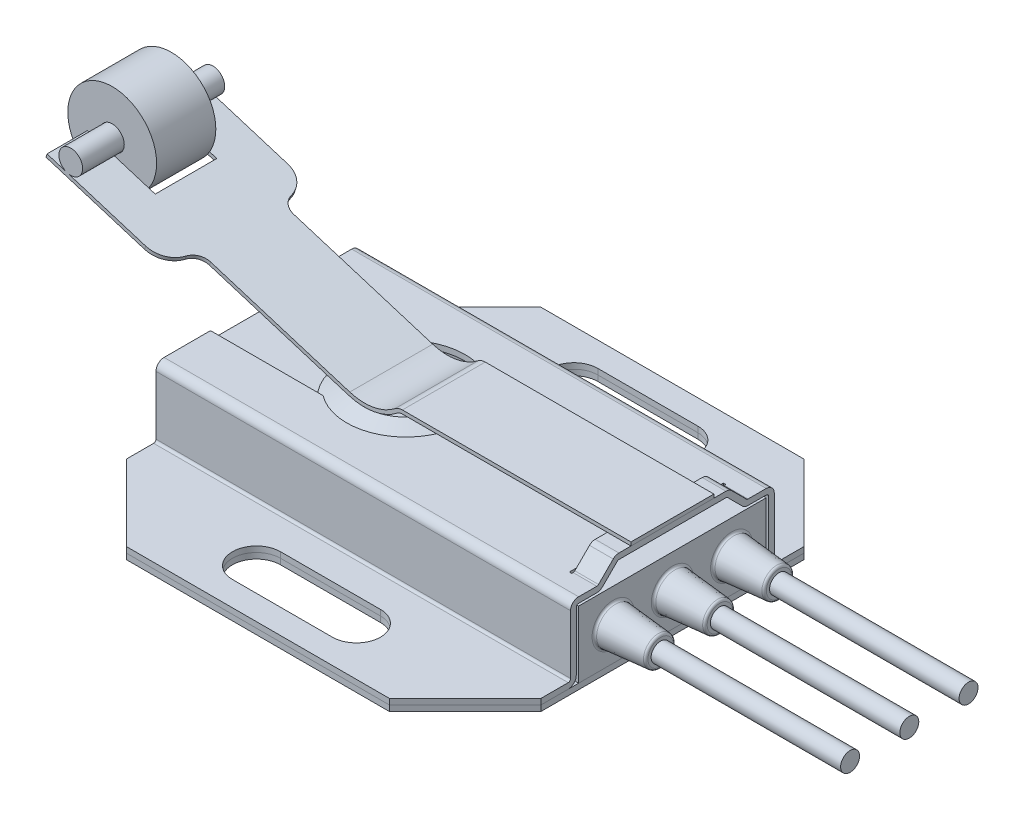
SolidWorks part; units mm, degrees
ref_plane "Front" through (0, 0, 0) normal (0, 0, 1) x (1, 0, 0)
ref_plane "Top" through (0, 0, 0) normal (0, 1, 0) x (1, 0, 0)
ref_plane "Right" through (0, 0, 0) normal (1, 0, 0) x (0, 0, -1)
sketch "Sketch1" plane through (0, 0, 0) normal (0, 1, 0) x (1, 0, 0)
  line L0 (-22.225, 0) -> (-5.3594, 0) construction
  line L1 (-22.225, 22.225) -> (-22.225, -22.225)
  line L2 (-22.225, -22.225) -> (22.225, -22.225)
  line L4 (5.3594, 17.018) -> (-5.3594, 17.018) construction
  line L5 (-5.3594, -17.018) -> (5.3594, -17.018) construction
  line L6 (5.3594, 19.5961) -> (-5.3594, 19.5961) construction
  line L7 (-5.3594, -19.5961) -> (5.3594, -19.5961) construction
  line L8 (5.3594, 14.4399) -> (-5.3594, 14.4399) construction
  line L9 (-5.3594, -14.4399) -> (5.3594, -14.4399) construction
  line L10 (-5.3594, 17.018) -> (-5.3594, -17.018) construction
  line L11 (22.225, 22.225) -> (22.225, -22.225)
  line L12 (22.225, 22.225) -> (-22.225, 22.225)
  line L13 (-22.225, -22.225) -> (22.225, 22.225) construction
  line L14 (-22.225, 14.097) -> (-14.097, 22.225) construction
  line L15 (14.097, 22.225) -> (22.225, 14.097) construction
  line L16 (22.225, -14.097) -> (14.097, -22.225) construction
  line L17 (-22.225, -14.097) -> (-14.097, -22.225) construction
  line L18 (-14.097, -22.225) -> (-17.834, -18.488) construction
  arc A0 (5.3594, 19.5961) -> (5.3594, 14.4399) centre (5.3594, 17.018) cw construction
  arc A1 (-5.3594, 19.5961) -> (-5.3594, 14.4399) centre (-5.3594, 17.018) ccw construction
  arc A2 (-5.3594, -19.5961) -> (-5.3594, -14.4399) centre (-5.3594, -17.018) cw construction
  arc A3 (5.3594, -19.5961) -> (5.3594, -14.4399) centre (5.3594, -17.018) ccw construction
  point P16 (0, -19.5961)
  dimension "D4" = 34.036
  dimension "D2" = 15.875
  dimension "D1" = 5.1562
  dimension "D3" = 44.45
  dimension "D5" = 44.45
  dimension "D6" = 22.225
  dimension "D7" = 8.128
extrude "Extrude1" add sketch "Sketch1" along normal blind 0.6096
sketch "Sketch2" plane through (22.225, 0, 0) normal (-1, 0, 0) x (0, 0, 1)
  line L0 (10.922, 8.636) -> (8.001, 8.636)
  line L1 (8.001, 8.636) -> (6.096, 10.541)
  line L2 (6.096, 10.541) -> (-6.096, 10.541)
  line L3 (-6.096, 10.541) -> (-8.001, 8.636)
  line L4 (-8.001, 8.636) -> (-10.922, 8.636)
  line L5 (-10.922, 8.636) -> (-10.922, 8.0264)
  line L6 (-10.922, 8.0264) -> (-10.3124, 8.0264) construction
  line L7 (-7.7485, 8.0264) -> (-5.8435, 9.9314)
  line L8 (-5.8435, 9.9314) -> (5.8435, 9.9314)
  line L9 (5.8435, 9.9314) -> (7.7485, 8.0264)
  line L10 (7.7485, 8.0264) -> (10.3124, 8.0264)
  line L11 (10.922, 1.2192) -> (10.922, 8.636)
  line L12 (0, 10.541) -> (0, 9.9314) construction
  line L13 (-7.0485, 9.5885) -> (-6.6174, 9.1574) construction
  line L14 (7.0485, 9.5885) -> (6.6174, 9.1574) construction
  line L15 (-10.922, 1.2192) -> (-22.225, 1.2192)
  line L16 (-22.225, 1.2192) -> (-22.225, 0.6096)
  line L17 (10.3124, 8.0264) -> (10.3124, 0.6096)
  line L18 (10.3124, 0.6096) -> (22.225, 0.6096)
  line L19 (-10.922, 8.0264) -> (-10.922, 1.2192)
  line L20 (-22.225, 0.6096) -> (-10.3124, 0.6096)
  line L21 (-10.3124, 0.6096) -> (-10.3124, 8.0264)
  line L22 (-10.3124, 8.0264) -> (-7.7485, 8.0264)
  line L23 (22.225, 0.6096) -> (22.225, 1.2192)
  line L24 (22.225, 1.2192) -> (10.922, 1.2192)
  line L25 (10.3124, 8.0264) -> (10.922, 8.0264) construction
  line L26 (-10.922, 1.2192) -> (-10.3124, 1.2192) construction
  line L27 (10.922, 1.2192) -> (10.3124, 1.2192) construction
  line L28 (22.225, 0) -> (-22.225, 0) construction
  dimension "D1" = 8.636
  dimension "D2" = 21.844
  dimension "D4" = 135
  dimension "D5" = 12.192
  dimension "D6" = 0.6096
  dimension "D7" = 10.541
extrude "Extrude2" add sketch "Sketch2" along normal blind 2.54 separate body
sketch "Sketch20" plane through (22.225, 0, 0) normal (1, 0, 0) x (0, 0, -1)
  line L0 (8.001, 8.636) -> (10.922, 8.636) construction
  line L1 (10.3124, 8.0264) -> (7.7485, 8.0264) construction
  line L2 (-10.922, 8.636) -> (-8.001, 8.636) construction
  line L3 (-7.7485, 8.0264) -> (-10.3124, 8.0264) construction
  line L4 (10.3124, 0.6096) -> (10.3124, 8.0264) construction
  line L5 (10.922, 8.0264) -> (10.922, 1.2192) construction
  line L6 (22.225, 1.2192) -> (22.225, 0.6096) construction
  line L7 (22.225, 0.6096) -> (10.3124, 0.6096) construction
  line L8 (10.922, 1.2192) -> (22.225, 1.2192) construction
  line L9 (-10.922, 1.2192) -> (-10.922, 8.636) construction
  line L10 (-10.3124, 8.0264) -> (-10.3124, 0.6096) construction
  line L11 (-22.225, 0.6096) -> (-22.225, 1.2192) construction
  line L12 (-10.3124, 0.6096) -> (-22.225, 0.6096) construction
  line L13 (-22.225, 1.2192) -> (-10.922, 1.2192) construction
  line L14 (8.255, 8.636) -> (10.922, 8.636)
  line L15 (10.3124, 8.0264) -> (8.255, 8.0264)
  line L16 (-10.922, 8.636) -> (-8.255, 8.636)
  line L17 (-8.255, 8.0264) -> (-10.3124, 8.0264)
  line L18 (10.3124, 0.6096) -> (10.3124, 8.0264)
  line L19 (10.922, 8.636) -> (10.922, 1.2192)
  line L20 (22.225, 1.2192) -> (22.225, 0.6096)
  line L21 (22.225, 0.6096) -> (10.3124, 0.6096)
  line L22 (10.922, 1.2192) -> (22.225, 1.2192)
  line L23 (-10.922, 1.2192) -> (-10.922, 8.636)
  line L24 (-10.3124, 8.0264) -> (-10.3124, 0.6096)
  line L25 (-22.225, 0.6096) -> (-22.225, 1.2192)
  line L26 (-10.3124, 0.6096) -> (-22.225, 0.6096)
  line L27 (-22.225, 1.2192) -> (-10.922, 1.2192)
  line L28 (-8.255, 8.636) -> (-8.255, 8.0264)
  line L29 (8.255, 8.636) -> (8.255, 8.0264)
  dimension "D1" = 0.254
  dimension "D2" = 0.254
extrude "Extrude14" add sketch "Sketch20" against normal up to surface (44.45 mm away)
sketch "Sketch21" plane through (0, 8.636, 0) normal (0, 1, 0) x (-1, 0, 0)
  line L0 (22.225, 8.255) -> (-19.685, 8.255) construction
  line L1 (22.225, -8.255) -> (-19.431, -8.255)
  line L2 (22.225, -8.255) -> (22.225, 8.255)
  line L3 (22.225, 8.255) -> (-19.431, 8.255)
  line L4 (-19.431, -8.255) -> (-19.431, 8.255)
  line L5 (-19.685, 8.255) -> (-19.685, 8.001) construction
  dimension "D1" = 0.254
extrude "Extrude15" add sketch "Sketch21" against normal up to surface (0.6096 mm away)
fillet "Fillet2" radius 0.254 8 edges at (20.955, 8.636, 8.001) (20.955, 8.636, -8.001) (20.955, 9.9314, -5.8435) (0, 8.0264, -10.3124) (20.955, 9.9314, 5.8435) (0, 1.2192, -10.922) (0, 1.2192, 10.922) (0, 8.0264, 10.3124)
fillet "Fillet3" radius 0.8636 8 edges at (20.955, 8.0264, 7.7485) (20.955, 8.0264, -7.7485) (0, 8.636, -10.922) (20.955, 10.541, -6.096) (20.955, 10.541, 6.096) (0, 8.636, 10.922) (0, 0.6096, -10.3124) (0, 0.6096, 10.3124)
sketch "Sketch11" plane through (-1.8288, 0, 0) normal (0, 1, 0) x (0, 0, 1)
  line L0 (14.4399, -3.5306) -> (14.4399, 7.1882) construction
  line L1 (19.5961, -3.5306) -> (19.5961, 7.1882) construction
  line L2 (-19.5961, 7.1882) -> (-19.5961, -3.5306) construction
  line L3 (-14.4399, 7.1882) -> (-14.4399, -3.5306) construction
  line L4 (14.4399, -3.5306) -> (14.4399, 7.1882)
  line L5 (19.5961, -3.5306) -> (19.5961, 7.1882)
  line L6 (-19.5961, 7.1882) -> (-19.5961, -3.5306)
  line L7 (-14.4399, 7.1882) -> (-14.4399, -3.5306)
  line L8 (-22.225, 24.0538) -> (22.225, 24.0538) construction
  line L9 (22.225, -20.3962) -> (22.225, 24.0538) construction
  line L10 (-22.225, -20.3962) -> (22.225, -20.3962) construction
  line L11 (-22.225, 24.0538) -> (-22.225, -20.3962) construction
  line L12 (-14.097, -20.3962) -> (-22.225, -12.2682) construction
  line L13 (14.097, -20.3962) -> (22.225, -12.2682) construction
  line L14 (14.097, 24.0538) -> (22.225, 15.9258) construction
  line L15 (-22.225, 15.9258) -> (-14.097, 24.0538) construction
  line L16 (-22.225, 24.0538) -> (-14.097, 24.0538)
  line L17 (22.225, -20.3962) -> (22.225, -12.2682)
  line L18 (-22.225, -20.3962) -> (-14.097, -20.3962)
  line L19 (-22.225, 24.0538) -> (-22.225, 15.9258)
  line L20 (-14.097, -20.3962) -> (-22.225, -12.2682)
  line L21 (14.097, -20.3962) -> (22.225, -12.2682)
  line L22 (14.097, 24.0538) -> (22.225, 15.9258)
  line L23 (-22.225, 15.9258) -> (-14.097, 24.0538)
  line L24 (-22.225, -12.2682) -> (-22.225, -20.3962)
  line L25 (14.097, 24.0538) -> (22.225, 24.0538)
  line L26 (22.225, 15.9258) -> (22.225, 24.0538)
  line L27 (14.097, -20.3962) -> (22.225, -20.3962)
  arc A0 (14.4399, -3.5306) -> (19.5961, -3.5306) centre (17.018, -3.5306) ccw construction
  arc A1 (19.5961, 7.1882) -> (14.4399, 7.1882) centre (17.018, 7.1882) ccw construction
  arc A2 (-14.4399, 7.1882) -> (-19.5961, 7.1882) centre (-17.018, 7.1882) ccw construction
  arc A3 (-19.5961, -3.5306) -> (-14.4399, -3.5306) centre (-17.018, -3.5306) ccw construction
  arc A4 (14.4399, -3.5306) -> (19.5961, -3.5306) centre (17.018, -3.5306) ccw
  arc A5 (19.5961, 7.1882) -> (14.4399, 7.1882) centre (17.018, 7.1882) ccw
  arc A6 (-14.4399, 7.1882) -> (-19.5961, 7.1882) centre (-17.018, 7.1882) ccw
  arc A7 (-19.5961, -3.5306) -> (-14.4399, -3.5306) centre (-17.018, -3.5306) ccw
extrude "Cut-Extrude3" cut sketch "Sketch11" along normal through all
ref_plane "Plane1" through (0, 0, 0) normal (0, 0, 1) x (1, 0, 0)
sketch "Sketch12" plane through (0, 0, 0) normal (0, 0, 1) x (1, 0, 0)
  line L0 (22.225, 10.541) -> (-2.288, 10.541)
  line L1 (-8.0392, 9.3994) -> (-37.3236, 18.46)
  line L2 (-37.3236, 18.46) -> (-37.211, 18.824)
  line L3 (-37.211, 18.824) -> (-7.9266, 9.7633)
  line L4 (-2.288, 10.922) -> (22.225, 10.922)
  line L5 (22.225, 10.922) -> (22.225, 10.541)
  line L8 (-22.225, 0) -> (-5.3594, 0) construction
  line L9 (-22.225, 8.636) -> (19.431, 8.636) construction
  line L10 (-22.225, 8.636) -> (19.431, 8.636) construction
  line L11 (-6.35, 14.859) -> (-6.35, 9.144) construction
  line L12 (-6.35, 9.144) -> (-6.35, 8.636) construction
  arc A0 (-2.288, 10.541) -> (-2.8348, 10.3529) centre (-2.288, 9.652) ccw
  arc A1 (-2.8348, 10.3529) -> (-8.0392, 9.3994) centre (-6.35, 14.859) cw
  arc A2 (-7.9266, 9.7633) -> (-3.0691, 10.6533) centre (-6.35, 14.859) ccw
  arc A3 (-3.0691, 10.6533) -> (-2.288, 10.922) centre (-2.288, 9.652) cw
  circle A4 centre (-34.671, 19.3675) radius 1.27 construction
  circle A5 centre (-34.671, 19.3675) radius 4.7625 construction
  point P21 (-34.671, 19.3675)
  dimension "D1" = 9.525
  dimension "D2" = 12.446
  dimension "D5" = 2.54
  dimension "D6" = 28.575
  dimension "D7" = 2.54
  dimension "D8" = 5.715
  dimension "D9" = 1.27
  dimension "D3" = 24.13
  dimension "D4" = 0.381
  dimension "D10" = 0.508
extrude "Extrude9" add sketch "Sketch12" along normal mid plane 15.24 separate body
sketch "Sketch13" plane through (2.0644, 6.6721, 0) normal (0.2956, 0.9553, 0) x (-0.9553, 0.2956, 0)
  line L0 (41.1123, 3.302) -> (33.4923, 3.302)
  line L1 (33.4923, 3.302) -> (33.4923, -3.302)
  line L2 (33.4923, -3.302) -> (41.1123, -3.302)
  line L3 (41.1123, -3.302) -> (41.1123, 3.302)
  line L4 (27.6037, 7.62) -> (27.6037, 5.969)
  line L5 (26.0797, 4.445) -> (-18.1163, 4.445)
  line L6 (-18.1163, 4.445) -> (-18.1163, 7.62)
  line L7 (-18.1163, 7.62) -> (27.6037, 7.62)
  line L8 (-18.1163, -7.62) -> (27.6037, -7.62)
  line L9 (27.6037, -7.62) -> (27.6037, -5.969)
  line L10 (26.0797, -4.445) -> (-18.1163, -4.445)
  line L11 (-18.1163, -4.445) -> (-18.1163, -7.62)
  line L12 (10.4583, -7.62) -> (41.1123, -7.62) construction
  line L13 (10.4583, 7.62) -> (41.1123, 7.62) construction
  line L14 (-18.1163, 7.62) -> (-18.1163, -7.62) construction
  line L15 (41.1123, 7.62) -> (41.1123, -7.62) construction
  line L16 (26.0797, 5.969) -> (26.0797, -5.969) construction
  line L17 (26.0797, 0) -> (33.4923, 0) construction
  arc A0 (27.6037, 5.969) -> (26.0797, 4.445) centre (26.0797, 5.969) cw
  arc A1 (27.6037, -5.969) -> (26.0797, -4.445) centre (26.0797, -5.969) ccw
  dimension "D3" = 1.524
  dimension "D1" = 6.604
  dimension "D2" = 7.62
  dimension "D4" = 8.89
  dimension "D5" = 45.72
extrude "Cut-Extrude4" cut sketch "Sketch13" against normal through all and the other way through all
fillet "Fillet6" radius 2.54 2 edges at (-24.3623, 14.6492, 7.62) (-24.3623, 14.6492, -7.62)
sketch "Sketch14" plane through (0, 0, 0) normal (0, 0, 1) x (1, 0, 0)
  line L0 (-35.2752, 18.2505) -> (-35.2752, 18.2251)
  line L1 (-35.2752, 18.2251) -> (-34.8032, 18.079)
  line L2 (-34.8032, 18.079) -> (-34.8032, 18.1044)
  line L3 (-22.8501, 14.3807) -> (19.3712, 1.3173) construction
  circle A0 centre (-34.671, 19.3675) radius 1.27 construction
  arc A1 (-34.8032, 18.1044) -> (-35.2752, 18.2505) centre (-34.671, 19.3675) ccw
  arc A2 (-35.2752, 18.2505) -> (-34.8032, 18.1044) centre (-34.671, 19.3675) ccw construction
  dimension "D1" = 0.0254
extrude "Extrude10" add sketch "Sketch14" along normal mid plane 15.24
sketch "Sketch15" plane through (0, 0, 0) normal (0, 0, 1) x (1, 0, 0)
  line L0 (-34.671, 19.3675) -> (-34.671, 20.6375) construction
  line L1 (-34.671, 20.6375) -> (-34.671, 20.6629) construction
  circle A0 centre (-34.671, 19.3675) radius 4.7625 construction
  circle A1 centre (-34.671, 19.3675) radius 4.7625
  circle A2 centre (-34.671, 19.3675) radius 1.27 construction
  circle A3 centre (-34.671, 19.3675) radius 1.27 construction
  circle A4 centre (-34.671, 19.3675) radius 1.2954
  dimension "D1" = 0.0254
extrude "Extrude11" add sketch "Sketch15" along normal mid plane 6.35 separate body
sketch "Sketch17" plane through (0, 0, 0) normal (0, 0, 1) x (1, 0, 0)
  line L0 (-6.35, 9.144) -> (-10.795, 9.144)
  line L1 (-10.795, 9.144) -> (-13.335, 7.62)
  line L2 (-13.335, 7.62) -> (-6.35, 7.62)
  line L3 (-6.35, 7.62) -> (-6.35, 9.144)
  line L4 (-6.35, 9.144) -> (-6.35, 10.668) construction
  arc A0 (-8.0392, 9.3994) -> (-2.8348, 10.3529) centre (-6.35, 14.859) ccw construction
  dimension "D1" = 8.89
  dimension "D2" = 13.97
  dimension "D3" = 1.524
revolve "Revolve1" add sketch "Sketch17" angle 360 about L4
sketch "Sketch18" plane through (22.225, 0, 0) normal (-1, 0, 0) x (0, 0, 1)
  line L1 (10.0584, 7.7724) -> (-10.0584, 7.7724)
  line L2 (10.0584, 7.7724) -> (10.0584, 0.6096)
  line L3 (10.0584, 0.6096) -> (-10.0584, 0.6096)
  line L4 (-10.0584, 7.7724) -> (-10.0584, 0.6096)
  line L8 (-22.225, 0.6096) -> (-10.3124, 0.6096) construction
  line L10 (10.3124, 8.0264) -> (10.3124, 0.6096) construction
  line L11 (7.7485, 8.0264) -> (10.3124, 8.0264) construction
  line L12 (-10.3124, 0.6096) -> (-10.3124, 8.0264) construction
  dimension "D1" = 0.254
  dimension "D2" = 0.254
  dimension "D3" = 0.254
extrude "Extrude12" add sketch "Sketch18" along normal up to surface (44.45 mm away)
sketch "Sketch19" plane through (22.225, 0, 0) normal (-1, 0, 0) x (0, 0, 1)
  line L0 (-6.35, 4.191) -> (0, 4.191) construction
  line L1 (0, 4.191) -> (6.35, 4.191) construction
  line L2 (10.0584, 0.6096) -> (-10.0584, 7.7724) construction
  circle A0 centre (-6.35, 4.191) radius 1.016
  circle A1 centre (0, 4.191) radius 1.016
  circle A2 centre (6.35, 4.191) radius 1.016
  dimension "D1" = 12.7
  dimension "D2" = 2.032
extrude "Extrude13" add sketch "Sketch19" against normal blind 25.4
sketch "Sketch22" plane through (0, 8.636, 0) normal (0, 1, 0) x (-1, 0, 0)
  line L0 (22.225, 10.0584) -> (22.225, -10.0584) construction
  line L1 (10.16, -5.08) -> (22.225, -5.08)
  line L3 (10.16, 5.08) -> (22.225, 5.08)
  line L4 (22.225, -5.08) -> (22.225, 5.08)
  arc A0 (10.16, 5.08) -> (10.16, -5.08) centre (6.35, 0) ccw
  dimension "D1" = 12.7
  dimension "D2" = 10.16
extrude "Cut-Extrude5" cut sketch "Sketch22" against normal up to next (0.6096 mm away)
sketch "Sketch23" plane through (22.225, 0, 0) normal (1, 0, 0) x (0, 0, -1)
  line L0 (-6.35, 4.191) -> (-6.35, 5.207) construction
  line L1 (-6.35, 5.207) -> (-6.35, 6.223) construction
  circle A0 centre (-6.35, 4.191) radius 1.016 construction
  circle A1 centre (-6.35, 4.191) radius 1.016 construction
  circle A2 centre (-6.35, 4.191) radius 2.032
  circle A3 centre (0, 4.191) radius 2.032
  circle A4 centre (6.35, 4.191) radius 2.032
extrude "Extrude16" add sketch "Sketch23" along normal blind 5.08 draft 5
fillet "Fillet7" radius 0.254 6 edges at (22.225, 4.191, -8.382) (27.305, 4.191, -7.9376) (22.225, 4.191, -2.032) (27.305, 4.191, -1.5876) (22.225, 4.191, 4.318) (27.305, 4.191, 4.7624)
